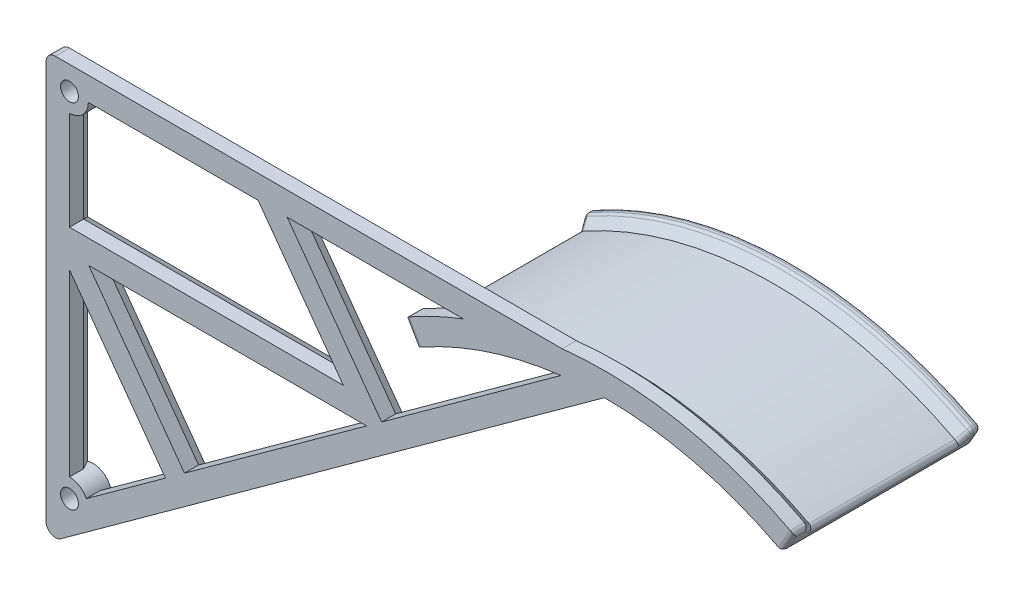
SolidWorks part; units mm, degrees
other "Camera1"
ref_plane "Front" through (0, 0, 0) normal (0, 0, 1) x (1, 0, 0)
ref_plane "Top" through (0, 0, 0) normal (0, 1, 0) x (1, 0, 0)
ref_plane "Right" through (0, 0, 0) normal (1, 0, 0) x (0, 0, -1)
sketch "Sketch7" plane through (0, 0, 0) normal (0, 0, 1) x (1, 0, 0)
  line L0 (0, 0) -> (0, 90.5955)
  line L1 (0, 90.5955) -> (125, 90.5955)
  line L2 (125, 90.5955) -> (0, 0)
  line L3 (5, 81.5955) -> (5, 60.5955)
  line L5 (109.581, 85.5955) -> (51.2947, 85.5955)
  line L6 (5, 52.7306) -> (25.3997, 24.5839)
  line L7 (29.4482, 27.5181) -> (9.0988, 55.5955)
  line L8 (71.3675, 57.8997) -> (51.2947, 85.5955)
  line L9 (63.2387, 60.5955) -> (45.1196, 85.5955)
  line L10 (5, 60.5955) -> (63.2387, 60.5955)
  line L11 (9.0988, 55.5955) -> (68.1882, 55.5955)
  line L14 (71.3675, 57.8997) -> (109.581, 85.5955)
  line L15 (29.4482, 27.5181) -> (68.1882, 55.5955)
  line L16 (45.1196, 85.5955) -> (9, 85.5955)
  line L17 (5, 52.7306) -> (5, 14.5955)
  line L18 (8.5749, 12.3899) -> (25.3997, 24.5839)
  arc A2 (5, 81.5955) -> (9, 85.5955) centre (5, 85.5955) ccw
  arc A3 (8.5749, 12.3899) -> (5, 14.5955) centre (5, 10.5955) ccw
  dimension "D6" = 5
  dimension "D2" = 5
  dimension "D5" = 75
  dimension "D1" = 125
  dimension "D3" = 5
  dimension "D4" = 5
  dimension "D7" = 5
  dimension "D8" = 5
  dimension "D9" = 25
extrude "Boss-Extrude1" add sketch "Sketch7" along normal blind 5
fillet "Fillet1" radius 2 3 edges at (0, 90.5955, 2.5) (0, 0, 2.5) (125, 90.5955, 2.5)
hole_wizard "CBORE for M3 Cheese Head Screw1" positions "Sketch10" profile "Sketch11" counterbore size "M3" standard "ISO"
sketch "Sketch10" plane through (0, 0, 0) normal (0, 0, -1) x (-1, 0, 0)
  point P10 (-5, 10.5955)
  point P13 (-5, 85.5955)
sketch "Sketch11" plane through (5, 10.5955, 0) normal (1, 0, 0) x (0, 1, 0)
  line L0 (0, 0) -> (0, 5)
  line L1 (0, 5) -> (1.9, 5)
  line L3 (1.9, 5) -> (1.9, 2)
  line L4 (1.9, 2) -> (3.25, 2)
  line L5 (3.25, 2) -> (3.25, 0)
  line L7 (3.25, 0) -> (0, 0)
  line L11 (0, -6.35) -> (0, 107.95) construction
  dimension "Thru Hole Dia." = 3.8
  dimension "Thru Hole Depth" = 5
  dimension "C'Bore Dia." = 6.5
  dimension "C'Bore Depth" = 2
chamfer "Chamfer5" distance 2 angle 30 13 edges at (80.4379, 85.5955, 0) (16.9873, 18.4869, 0) (5, 33.663, 0) (15.1998, 38.6572, 0) (19.2735, 41.5568, 0) (48.8182, 41.5568, 0) (38.6435, 55.5955, 0) (27.0598, 85.5955, 0) (54.1791, 73.0955, 0) (34.1193, 60.5955, 0) (5, 71.0955, 0) (90.4743, 71.7476, 0) (61.3311, 71.7476, 0)
sketch "Sketch12" plane through (0, 0, 0) normal (0, 0, 1) x (1, 0, 0)
  line L1 (156.6888, 76.5564) -> (159.1899, 80.8885)
  line L2 (78.8324, 75.3623) -> (76.3324, 79.6924)
  arc A1 (159.1899, 80.8885) -> (76.3324, 79.6924) centre (118.8324, 6.0803) ccw
  arc A2 (156.6888, 76.5564) -> (78.8324, 75.3623) centre (118.8324, 6.0803) ccw
  point P6 (0, 0)
  point P8 (118.9379, 88.2165)
extrude "Boss-Extrude2" add sketch "Sketch12" against normal blind 35 and the other way up to surface contours A2 L2 A1 L1
sketch "Sketch14" plane through (0, 0, 0) normal (0, 0, 1) x (1, 0, 0)
  line L0 (199.9258, 23.7684) -> (180.0177, 115.0392)
  line L1 (180.0177, 115.0392) -> (60.2376, 111.6288)
  line L2 (60.2376, 111.6288) -> (63.9365, 68.3333)
  arc A0 (199.9258, 23.7684) -> (63.9365, 68.3333) centre (118.8324, 6.0803) ccw
extrude "Cut-Extrude1" cut sketch "Sketch14" against normal blind 33
chamfer "Chamfer8" distance 2 angle 45 5 edges at (60.9719, 44.1902, 0) (1.091, 2.1381, 0) (0, 46.2575, 0) (0.5858, 90.0097, 0) (55.8835, 90.5955, 0)
chamfer "Chamfer9" distance 2 angle 45 1 edges at (129.5284, 90.4046, 0)
chamfer "Chamfer10" distance 2 angle 45 2 edges at (84.0113, 83.6205, 0) (117.6055, 89.0712, -33)
fillet "Fillet3" radius 1 19 edges at (76.3324, 79.6924, 3.5) (76.3324, 79.6924, -34) (159.1899, 80.8885, -34) (159.1899, 80.8885, 3.5) (117.6055, 91.0714, -35) (77.5824, 77.5274, -35) (117.6055, 86.0709, -35) (157.9394, 78.7225, -35) (156.6888, 76.5564, -15) (157.9394, 78.7225, 5) (158.1895, 79.1557, -15.5) (77.5824, 77.5274, 5) (78.8324, 75.3623, -15) (77.3324, 77.9604, -15.5) (76.8324, 78.8264, 1) (117.6055, 91.0714, -33) (76.8324, 78.8264, -32)
